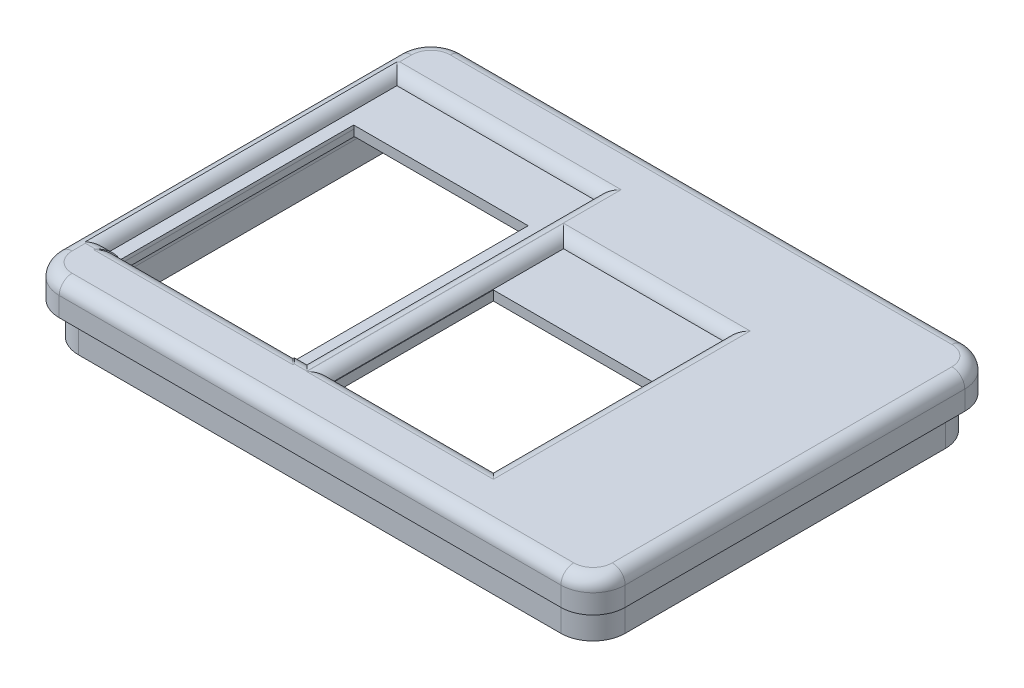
SolidWorks part; units mm, degrees
ref_plane "Front Plane" through (0, 0, 0) normal (0, 0, 1) x (1, 0, 0)
ref_plane "Top Plane" through (0, 0, 0) normal (0, 1, 0) x (1, 0, 0)
ref_plane "Right Plane" through (0, 0, 0) normal (1, 0, 0) x (0, 0, -1)
sketch "Sketch4" plane through (0, 0, 0) normal (0, 1, 0) x (1, 0, 0)
  line L1 (-43, -31.4) -> (45, -31.4)
  line L2 (-43, -31.4) -> (-43, 31.4)
  line L3 (-43, 31.4) -> (45, 31.4)
  line L4 (45, -31.4) -> (45, 31.4)
  line L5 (-40, 28.4) -> (42, 28.4)
  line L6 (-40, 28.4) -> (-40, -28.4)
  line L7 (-40, -28.4) -> (42, -28.4)
  line L8 (42, 28.4) -> (42, -28.4)
  point P0 (0, 0)
  point P6 (0, 0)
  dimension "D1" = 3
  dimension "D2" = 3
  dimension "D3" = 82
  dimension "D4" = 56.8
  dimension "D5" = 3
  dimension "D6" = 3
extrude "Boss-Extrude1" add sketch "Sketch4" along normal blind 7
sketch "Sketch5" plane through (0, 7, 0) normal (0, 1, 0) x (1, 0, 0)
  line L5 (-43, 31.4) -> (45, 31.4)
  line L6 (-43, 31.4) -> (-43, -31.4)
  line L7 (-43, -31.4) -> (45, -31.4)
  line L8 (45, 31.4) -> (45, -31.4)
  point P0 (0, 0)
extrude "Boss-Extrude2" add sketch "Sketch5" along normal blind 3
sketch "Sketch6" plane through (0, 0, 0) normal (0, -1, 0) x (1, 0, 0)
  line L0 (-24, 22.55) -> (-24, 31.4) construction
  line L5 (-43, 31.4) -> (45, 31.4) construction
  line L6 (45, 31.4) -> (45, -31.4) construction
  line L7 (-43, -31.4) -> (-43, 31.4) construction
  line L15 (-10.5, 22.55) -> (-10.5, -13.95)
  line L16 (-10.5, -13.95) -> (-37.5, -13.95)
  line L17 (-37.5, 22.55) -> (-37.5, -13.95)
  line L18 (-10.5, 22.55) -> (-37.5, 22.55)
  line L19 (-4.5, 22.4) -> (20.5, 22.4)
  line L20 (-4.5, 22.4) -> (-4.5, -2.6)
  line L21 (-4.5, -2.6) -> (20.5, -2.6)
  line L22 (20.5, 22.4) -> (20.5, -2.6)
  point P8 (0, 0)
  point P9 (0, 0)
  dimension "D1" = 27
  dimension "D2" = 36.5
  dimension "D3" = 0.15
  dimension "D4" = 25
  dimension "D5" = 25
  dimension "D7" = 24.5
  dimension "D8" = 5.5
  dimension "D9" = 9
extrude "Cut-Extrude1" cut sketch "Sketch6" against normal through all
sketch "Sketch9" plane through (0, 0, 0) normal (0, 1, 0) x (1, 0, 0)
  line L0 (42, -28.4) -> (42, 28.4) construction
  line L1 (-41.5, -29.9) -> (43.5, -29.9)
  line L2 (-41.5, -29.9) -> (-41.5, 29.8771)
  line L3 (-41.5, 29.8771) -> (43.5, 29.8771)
  line L4 (43.5, -29.9) -> (43.5, 29.8771)
  line L5 (-43, -31.4) -> (45, -31.4) construction
  line L6 (-43, 31.4) -> (-43, -31.4) construction
  line L9 (-43, -31.4) -> (45, -31.4)
  line L10 (-43, -31.4) -> (-43, 31.4)
  line L11 (-43, 31.4) -> (45, 31.4)
  line L12 (45, -31.4) -> (45, 31.4)
  dimension "D1" = 1.5
  dimension "D2" = 1.5
  dimension "D3" = 1.5
extrude "Cut-Extrude4" cut sketch "Sketch9" along normal blind 5
sketch "Sketch12" plane through (0, 10, 0) normal (0, 1, 0) x (1, 0, 0)
  line L0 (-10.5, 13.95) -> (-10.5, -22.55) construction
  line L1 (-8.5, -22.4) -> (-39.5, -22.4)
  line L2 (-8.5, -22.4) -> (-8.5, 22.6)
  line L3 (-8.5, 22.6) -> (-39.5, 22.6)
  line L4 (-39.5, -22.4) -> (-39.5, 22.6)
  line L9 (20.5, -22.4) -> (-4.5892, -22.4)
  line L10 (20.5, -22.4) -> (20.5, 13.6)
  line L11 (20.5, 13.6) -> (-4.5892, 13.6)
  line L12 (-4.5892, -22.4) -> (-4.5892, 13.6)
  dimension "D1" = 45
  dimension "D2" = 2
  dimension "D3" = 31
  dimension "D4" = 36
extrude "Cut-Extrude5" cut sketch "Sketch12" against normal blind 1.5
fillet "Fillet1" radius 5 2 edges at (-41.5, 2.5, -29.8771) (-43, 7.5, -31.4)
fillet "Fillet2" radius 5 1 edges at (-40, 3.5, -28.4)
fillet "Fillet3" radius 5 2 edges at (-43, 7.5, 31.4) (-41.5, 2.5, 29.9)
fillet "Fillet4" radius 5 1 edges at (-40, 3.5, 28.4)
fillet "Fillet5" radius 5 3 edges at (45, 7.5, 31.4) (43.5, 2.5, 29.9) (42, 3.5, 28.4)
fillet "Fillet6" radius 5 3 edges at (45, 7.5, -31.4) (43.5, 2.5, -29.8771) (42, 3.5, -28.4)
fillet "Fillet7" radius 2 20 edges at (43.5355, 10, 29.9355) (1, 10, 31.4) (-41.5355, 10, 29.9355) (-43, 10, 0) (-41.5355, 10, -29.9355) (1, 10, -31.4) (43.5355, 10, -29.9355) (45, 10, 0) (-4.5892, 10, 4.4) (7.9554, 10, 22.4) (20.5, 10, 4.4) (7.9554, 10, -13.6) (-8.5, 10, -0.1) (-24, 10, -22.6) (-39.5, 10, -0.1) (-38.5, 10, 22.4) (-37.5, 10, 22.475) (-24, 10, 22.55) (-10.5, 10, 22.475) (-9.5, 10, 22.4)
fillet "Fillet8" radius 3 8 edges at (40.5355, 7, -26.9355) (1, 7, -28.4) (-38.5355, 7, -26.9355) (-40, 7, 0) (-38.5355, 7, 26.9355) (42, 7, 0) (40.5355, 7, 26.9355) (1, 7, 28.4)
